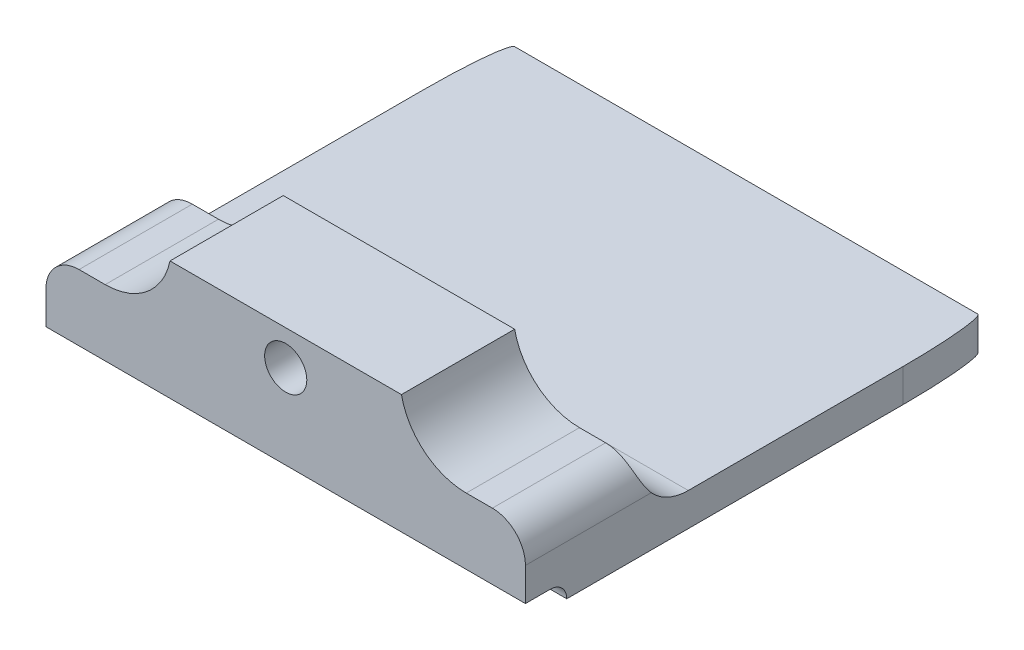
SolidWorks part; units mm, degrees
ref_plane "Front Plane" through (0, 0, 0) normal (0, 0, 1) x (1, 0, 0)
ref_plane "Top Plane" through (0, 0, 0) normal (0, 1, 0) x (1, 0, 0)
ref_plane "Right Plane" through (0, 0, 0) normal (1, 0, 0) x (0, 0, -1)
sketch "Sketch2" plane through (0, 0, 0) normal (0, 0, 1) x (1, 0, 0)
  line L1 (-29, -12.2) -> (29, -12.2)
  line L2 (-29, -12.2) -> (-29, 4.2)
  line L3 (-29, 4.2) -> (29, 4.2)
  line L4 (29, -12.2) -> (29, 4.2)
  circle A0 centre (0, 0) radius 2.55
  point P7 (0, 4.2)
  dimension "D1" = 5.1
  dimension "D2" = 4.2
  dimension "D3" = 58
  dimension "D4" = 12.2
extrude "Boss-Extrude1" add sketch "Sketch2" against normal blind 12.2
sketch "Sketch3" plane through (0, 0, -12.2) normal (0, 0, -1) x (-1, 0, 0)
  line L1 (-29, -12.2) -> (29, -12.2)
  line L2 (-29, -12.2) -> (-29, 4.2)
  line L3 (-29, 4.2) -> (29, 4.2)
  line L4 (29, -12.2) -> (29, 4.2)
extrude "Boss-Extrude2" add sketch "Sketch3" along normal blind 1.5
sketch "Sketch4" plane through (0, 0, -13.7) normal (0, 0, -1) x (-1, 0, 0)
  line L0 (29, -12.2) -> (29, 4.2) construction
  line L1 (-29, -12.2) -> (29, -12.2)
  line L2 (-29, -12.2) -> (-29, -8.2)
  line L3 (-29, -8.2) -> (29, -8.2)
  line L4 (29, -12.2) -> (29, -8.2)
  dimension "D1" = 4
extrude "Boss-Extrude3" add sketch "Sketch4" along normal blind 42
fillet "Fillet1" radius 10 1 edges at (29, -10.2, -55.7)
fillet "Fillet2" radius 10 1 edges at (-29, -10.2, -55.7)
fillet "Fillet3" radius 6 1 edges at (0, -8.2, -13.7)
sketch "Sketch5" plane through (0, 0, 0) normal (0, 0, 1) x (1, 0, 0)
  line L0 (0, 0) -> (0, 9.4705) construction
  line L1 (-29, 4.2) -> (-14, 4.2)
  line L2 (-29, 4.2) -> (-29, -2.2)
  line L3 (-29, -2.2) -> (-14, -2.2)
  line L4 (-14, 4.2) -> (-14, -2.2)
  line L5 (14, 4.2) -> (14, -2.2)
  line L6 (29, -2.2) -> (14, -2.2)
  line L7 (29, 4.2) -> (29, -2.2)
  line L8 (29, 4.2) -> (14, 4.2)
  dimension "D1" = 15
  dimension "D2" = 6.4
extrude "Cut-Extrude1" cut sketch "Sketch5" against normal up to next
fillet "Fillet4" radius 8 2 edges at (14, -2.2, -6.85) (-14, -2.2, -6.85)
fillet "Fillet5" radius 4 2 edges at (29, -2.2, -6.85) (-29, -2.2, -6.85)
sketch "Sketch6" plane through (-29, 0, 0) normal (-1, 0, 0) x (0, 0, 1)
  line L1 (0, -12.2) -> (-5, -12.2)
  line L2 (0, -12.2) -> (0, -10.2)
  line L3 (0, -10.2) -> (-5, -10.2)
  line L4 (-5, -12.2) -> (-5, -10.2)
  dimension "D1" = 2
  dimension "D2" = 5
extrude "Cut-Extrude2" cut sketch "Sketch6" against normal through all
fillet "Fillet6" radius 2 1 edges at (0, -10.2, -5)
